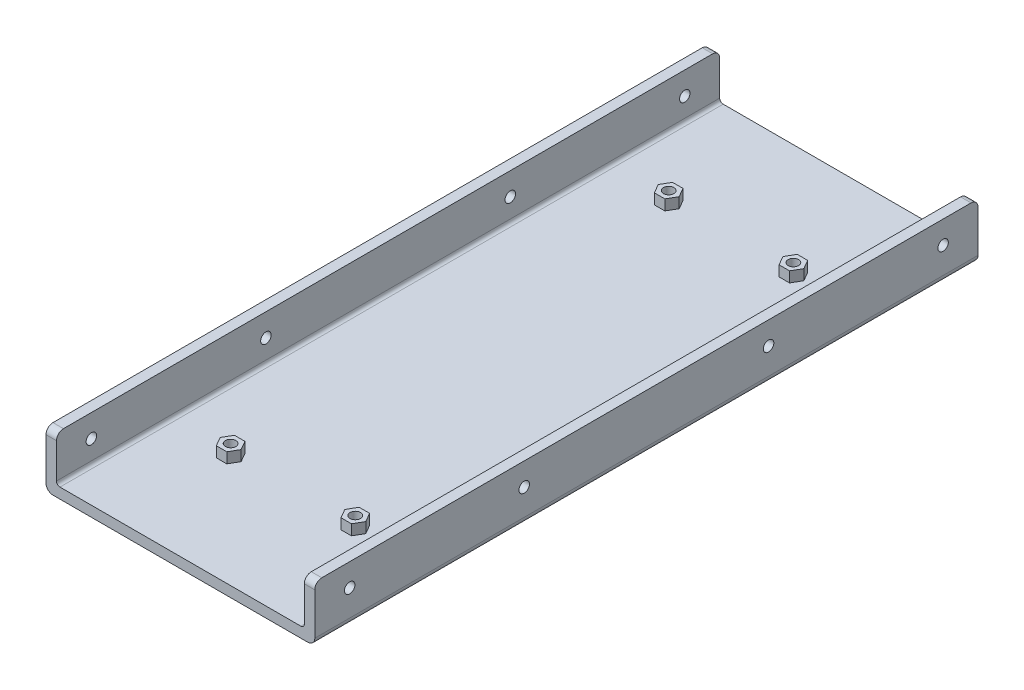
SolidWorks part; units mm, degrees
ref_plane "前视基准面" through (0, 0, 0) normal (0, 0, 1) x (1, 0, 0)
ref_plane "上视基准面" through (0, 0, 0) normal (0, 1, 0) x (1, 0, 0)
ref_plane "右视基准面" through (0, 0, 0) normal (1, 0, 0) x (0, 0, -1)
sketch "草图7" plane through (0, 0, 0) normal (0, 0, 1) x (1, 0, 0)
  line L1 (-52.4774, -31.3406) -> (49.5226, -31.3406) construction
  line L2 (49.5226, -31.3406) -> (49.5226, -15.3406)
  line L7 (-50.4774, -29.3406) -> (47.5226, -29.3406) construction
  line L8 (-52.4774, -31.3406) -> (-52.4774, -15.3406) construction
  line L9 (-50.4774, -29.3406) -> (-50.4774, -15.3406) construction
  line L10 (-50.4774, -15.3406) -> (-52.4774, -15.3406) construction
  line L11 (49.5226, -31.3406) -> (-27.4774, -31.3406)
  line L12 (-27.4774, -31.3406) -> (-27.4774, -15.3406)
  line L16 (49.5226, -15.3406) -> (46.5226, -15.3406)
  line L17 (-27.4774, -15.3406) -> (-24.4774, -15.3406)
  line L18 (-24.4774, -15.3406) -> (-24.4774, -28.3406)
  line L19 (46.5226, -15.3406) -> (46.5226, -28.3406)
  line L20 (46.5226, -28.3406) -> (-24.4774, -28.3406)
extrude "凸台-拉伸1" add sketch "草图7" along normal blind 190
fillet "圆角1" radius 2 2 edges at (49.5226, -31.3406, 95) (-27.4774, -31.3406, 95)
fillet "圆角2" radius 1 2 edges at (-24.4774, -28.3406, 95) (46.5226, -28.3406, 95)
sketch "草图10" plane through (49.5226, 0, 0) normal (-1, 0, 0) x (0, 0, 1)
  circle A13 centre (10, -21.8406) radius 1.5
  circle A17 centre (60, -21.8406) radius 1.5
  circle A18 centre (130, -21.8406) radius 1.5
  circle A19 centre (180, -21.8406) radius 1.5
extrude "切除-拉伸1" cut sketch "草图10" along normal up to surface (77 mm away)
ref_plane "基准面1" through (11.0226, 0, 0) normal (1, 0, 0) x (0, 0, -1)
sketch "草图12" plane through (0, -28.3406, 0) normal (0, 1, 0) x (1, 0, 0)
  line L5 (11.0226, -190) -> (11.0226, 0) construction
  line L84 (49.5226, -95) -> (-27.4774, -95) construction
  line L87 (-6.837, -157.75) -> (-6.837, -190) construction
  line L88 (49.5226, -157.75) -> (28.8823, -157.75) construction
  line L89 (28.8823, -157.75) -> (28.8823, -190) construction
  line L90 (25.8823, -157.75) -> (27.3823, -160.3481)
  line L91 (27.3823, -160.3481) -> (30.3823, -160.3481)
  line L92 (30.3823, -160.3481) -> (31.8823, -157.75)
  line L93 (31.8823, -157.75) -> (30.3823, -155.1519)
  line L94 (30.3823, -155.1519) -> (27.3823, -155.1519)
  line L95 (27.3823, -155.1519) -> (25.8823, -157.75)
  line L96 (-27.4774, -157.75) -> (-6.837, -157.75) construction
  line L97 (-5.337, -155.1519) -> (-3.837, -157.75)
  line L98 (-8.337, -155.1519) -> (-5.337, -155.1519)
  line L99 (-9.837, -157.75) -> (-8.337, -155.1519)
  line L100 (-8.337, -160.3481) -> (-9.837, -157.75)
  line L101 (-5.337, -160.3481) -> (-8.337, -160.3481)
  line L102 (-3.837, -157.75) -> (-5.337, -160.3481)
  line L103 (-27.4774, -32.25) -> (-6.837, -32.25) construction
  line L104 (28.8823, -32.25) -> (28.8823, 0) construction
  line L105 (49.5226, -32.25) -> (28.8823, -32.25) construction
  line L106 (-6.837, -32.25) -> (-6.837, 0) construction
  line L107 (-3.837, -32.25) -> (-5.337, -29.6519)
  line L108 (-5.337, -29.6519) -> (-8.337, -29.6519)
  line L109 (-8.337, -29.6519) -> (-9.837, -32.25)
  line L110 (-9.837, -32.25) -> (-8.337, -34.8481)
  line L111 (-8.337, -34.8481) -> (-5.337, -34.8481)
  line L112 (-5.337, -34.8481) -> (-3.837, -32.25)
  line L113 (27.3823, -34.8481) -> (25.8823, -32.25)
  line L114 (30.3823, -34.8481) -> (27.3823, -34.8481)
  line L115 (31.8823, -32.25) -> (30.3823, -34.8481)
  line L116 (30.3823, -29.6519) -> (31.8823, -32.25)
  line L117 (27.3823, -29.6519) -> (30.3823, -29.6519)
  line L118 (25.8823, -32.25) -> (27.3823, -29.6519)
  circle A0 centre (28.8823, -157.75) radius 2.5981 construction
  circle A1 centre (28.8823, -157.75) radius 1.5
  circle A14 centre (-6.837, -157.75) radius 2.5981 construction
  circle A15 centre (-6.837, -157.75) radius 1.5
  circle A16 centre (-6.837, -32.25) radius 2.5981 construction
  circle A17 centre (28.8823, -32.25) radius 2.5981 construction
  circle A18 centre (-6.837, -32.25) radius 1.5
  circle A19 centre (28.8823, -32.25) radius 1.5
  dimension "D1" = 125.5
extrude "凸台-拉伸3" add sketch "草图12" along normal blind 3
sketch "草图14" plane through (0, -25.3406, 0) normal (0, 1, 0) x (1, 0, 0)
  circle A1 centre (28.8823, -157.75) radius 1.5
  circle A2 centre (-6.837, -157.75) radius 1.5
  circle A3 centre (28.8823, -32.25) radius 1.5
  circle A4 centre (-6.837, -32.25) radius 1.5
extrude "切除-拉伸3" cut sketch "草图14" against normal blind 33
fillet "圆角3" radius 2 4 edges at (-25.9774, -15.3406, 190) (48.0226, -15.3406, 190) (-25.9774, -15.3406, 0) (48.0226, -15.3406, 0)
